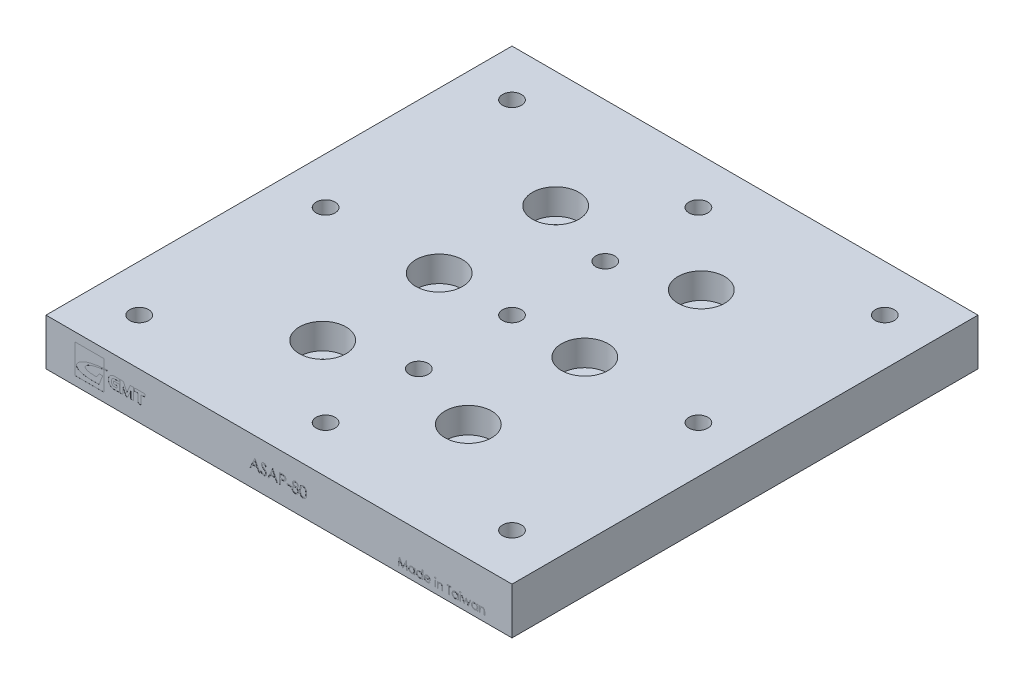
SolidWorks part; units mm, degrees
ref_plane "前基準面" through (0, 0, 0) normal (0, 0, 1) x (1, 0, 0)
ref_plane "上基準面" through (0, 0, 0) normal (0, 1, 0) x (1, 0, 0)
ref_plane "右基準面" through (0, 0, 0) normal (1, 0, 0) x (0, 0, -1)
sketch "草圖1" plane through (0, 0, 0) normal (0, 1, 0) x (1, 0, 0)
  line L1 (-40, 40) -> (40, 40)
  line L2 (-40, 40) -> (-40, -40)
  line L3 (-40, -40) -> (40, -40)
  line L4 (40, 40) -> (40, -40)
  dimension "D1" = 80
  dimension "D2" = 80
  dimension "D3" = 40
  dimension "D4" = 40
extrude "伸長1" add sketch "草圖1" along normal blind 8
ref_plane "平面1" through (0, 8, 0) normal (0, 1, 0) x (-1, 0, 0)
hole_wizard "M4 承窩頭蓋螺釘的柱孔1" positions "草圖3" profile "草圖2" counterbore size "M4" standard "JIS"
sketch "草圖3" plane through (0, 8, 0) normal (0, 1, 0) x (-1, 0, 0)
  point P0 (12.5, 20)
  dimension "D1" = 12.5
  dimension "D2" = 20
sketch "草圖2" plane through (-12.5, 8, 20) normal (1, 0, 0) x (0, 0, 1)
  line L0 (0, 0) -> (0, 8)
  line L1 (0, 8) -> (2.25, 8)
  line L3 (2.25, 8) -> (2.25, 4.4)
  line L4 (2.25, 4.4) -> (4, 4.4)
  line L5 (4, 4.4) -> (4, 0)
  line L7 (4, 0) -> (0, 0)
  line L11 (0, -6.35) -> (0, 107.95) construction
  dimension "貫穿孔直徑" = 4.5
  dimension "貫穿孔深度" = 8
  dimension "柱孔直徑" = 8
  dimension "柱孔深度" = 4.4
pattern_linear "直線複製排列1" count 2 spacing 25 along (1, 0, 0) count 3 spacing 20 along (0, 0, -1) of "M4 承窩頭蓋螺釘的柱孔1"
hole_wizard "M4x0.7 螺紋孔1" positions "草圖5" profile "草圖4" tap size "M4x0.7" standard "JIS"
sketch "草圖5" plane through (0, 8, 0) normal (0, 1, 0) x (-1, 0, 0)
  point P0 (32, 32)
  dimension "D1" = 32
  dimension "D2" = 32
sketch "草圖4" plane through (-32, 8, 32) normal (1, 0, 0) x (0, 0, 1)
  line L0 (0, 0) -> (0, 12.4764)
  line L1 (0, 12.4764) -> (1.625, 11.5)
  line L2 (1.625, 11.5) -> (1.625, 0)
  line L5 (1.625, 0) -> (0, 0)
  line L10 (0, 12.4764) -> (-1.625, 11.5) construction
  line L11 (0, -6.35) -> (0, 107.95) construction
  dimension "螺孔鑽直徑" = 3.25
  dimension "螺孔鑽深度" = 11.5
  dimension "導頭角度" = 118
pattern_linear "直線複製排列2" count 3 spacing 32 along (1, 0, 0) count 5 spacing 16 along (0, 0, -1) of "M4x0.7 螺紋孔1"
ref_plane "平面2" through (0, 0, 40) normal (0, 0, 1) x (1, 0, 0)
sketch "草圖6" plane through (0, 0, 40) normal (0, 0, 1) x (1, 0, 0)
  line L0 (-35, 6.5036) -> (-35, 1.5)
  line L1 (-35, 1.5) -> (-30.0015, 1.5)
  line L2 (-30.0015, 1.5) -> (-30.0015, 6.5036)
  line L3 (-35, 6.5036) -> (-30.0015, 6.5036)
  line L4 (-40, 0) -> (40, 0) construction
  line L5 (40, 8) -> (40, 0) construction
  dimension "D1" = 4.9985
  dimension "D2" = 5.0036
  dimension "D3" = 1.5
  dimension "D4" = 75
extrude "除料-伸長1" cut sketch "草圖6" against normal blind 0.01
sketch "草圖7" plane through (0, 0, 40) normal (0, 0, 1) x (1, 0, 0)
  line L0 (-35, 6.5036) -> (-35, 1.5)
  line L1 (-35, 1.5) -> (-30.0015, 1.5)
  line L2 (-30.0015, 1.5) -> (-30.0015, 4.8682)
  line L3 (-30.0015, 5.0224) -> (-30.0015, 6.5036)
  line L4 (-23.6912, 4.2729) -> (-23.6912, 2.7839)
  line L5 (-23.6912, 4.2729) -> (-23.1928, 4.2729)
  line L6 (-23.0365, 4.4292) -> (-23.0365, 4.7778)
  line L7 (-23.0365, 4.7778) -> (-24.8418, 4.7778)
  line L8 (-24.8418, 4.7778) -> (-24.8418, 4.2822)
  line L9 (-24.8418, 4.2822) -> (-24.1956, 4.2822)
  line L10 (-24.1956, 4.2822) -> (-24.1956, 2.943)
  line L11 (-24.0405, 2.7867) -> (-23.6912, 2.7839)
  line L12 (-24.9773, 4.7778) -> (-25.543, 4.7778)
  line L13 (-26.7119, 4.7778) -> (-27.2769, 4.7778)
  line L14 (-27.4068, 4.7778) -> (-28.4604, 4.7778)
  line L15 (-27.2769, 4.7778) -> (-27.2769, 2.7879)
  line L16 (-24.978, 2.7879) -> (-25.3139, 2.7879)
  line L17 (-25.9813, 2.7879) -> (-26.2736, 2.7879)
  line L18 (-26.941, 2.7879) -> (-27.2769, 2.7879)
  line L19 (-27.4177, 2.7879) -> (-28.4604, 2.7879)
  line L20 (-26.7119, 4.7778) -> (-26.1274, 3.4227)
  line L21 (-26.7846, 3.9449) -> (-26.7846, 2.9442)
  line L22 (-26.7846, 2.9442) -> (-26.7846, 3.9449)
  line L23 (-26.7846, 3.9449) -> (-26.2736, 2.7879)
  line L24 (-24.978, 4.7778) -> (-24.978, 2.7879)
  line L25 (-25.4703, 3.9449) -> (-25.4703, 2.9442)
  line L26 (-25.4703, 2.9442) -> (-25.4703, 3.9449)
  line L27 (-25.4703, 3.9449) -> (-25.9813, 2.7879)
  line L28 (-25.543, 4.7778) -> (-26.1274, 3.4227)
  line L29 (-27.4177, 4.0133) -> (-28.4232, 4.0133)
  line L30 (-27.4177, 4.0133) -> (-27.4177, 2.7879)
  line L31 (-28.4232, 4.0133) -> (-28.4232, 3.7451)
  line L32 (-27.8506, 3.5888) -> (-28.2668, 3.5888)
  line L33 (-27.8506, 3.5888) -> (-27.8506, 3.2081)
  line L34 (-27.8506, 3.2081) -> (-28.4604, 3.2081)
  line L35 (-27.4068, 4.7778) -> (-27.4068, 4.5291)
  line L36 (-28.4604, 4.3728) -> (-27.5632, 4.3728)
  line L37 (-30.904, 2.2321) -> (-30.2779, 3.8226)
  line L38 (-30.2779, 3.8226) -> (-30.842, 3.8222)
  line L39 (-30.842, 3.8222) -> (-31.3706, 3.1427)
  line L40 (-29.4562, 5.0787) -> (-29.4562, 4.9341)
  line L41 (-30.904, 2.2321) -> (-32.3854, 2.224)
  line L42 (-35, 6.5036) -> (-30.0015, 6.5036)
  arc A0 (-23.1928, 4.2729) -> (-23.0365, 4.4292) centre (-23.1928, 4.4292) ccw
  arc A1 (-24.1956, 2.943) -> (-24.0405, 2.7867) centre (-24.0392, 2.943) ccw
  arc A2 (-26.941, 2.7879) -> (-26.7846, 2.9442) centre (-26.941, 2.9442) ccw
  arc A3 (-25.4703, 2.9442) -> (-25.3139, 2.7879) centre (-25.3139, 2.9442) ccw
  arc A4 (-28.4232, 3.7451) -> (-28.2668, 3.5888) centre (-28.2668, 3.7451) ccw
  arc A5 (-27.5632, 4.3728) -> (-27.4068, 4.5291) centre (-27.5632, 4.5291) ccw
  arc A6 (-28.4604, 4.3728) -> (-28.4604, 3.2081) centre (-28.0971, 3.7905) ccw
  arc A7 (-28.4604, 4.7778) -> (-28.4604, 2.7879) centre (-28.2905, 3.7828) ccw
  arc A8 (-32.1055, 3.1701) -> (-31.3706, 3.1427) centre (-31.4486, 10.9141) ccw
  arc A9 (-32.707, 3.2503) -> (-32.1055, 3.1701) centre (-32.0766, 5.6836) ccw
  arc A10 (-33.1748, 3.4418) -> (-32.707, 3.2503) centre (-32.4818, 4.4675) ccw
  arc A11 (-33.2925, 3.6462) -> (-33.1748, 3.4418) centre (-33.0576, 3.6454) ccw
  arc A12 (-33.2183, 3.8151) -> (-33.2925, 3.6462) centre (-32.9716, 3.606) ccw
  arc A13 (-32.9666, 4.0385) -> (-33.2183, 3.8151) centre (-32.4029, 3.1499) ccw
  arc A14 (-32.6266, 4.2237) -> (-32.9666, 4.0385) centre (-31.5202, 1.7875) ccw
  arc A15 (-32.6266, 4.2237) -> (-32.2045, 4.3902) centre (-35.8318, 12.9711) ccw
  arc A16 (-32.2045, 4.3902) -> (-31.8263, 4.503) centre (-41.1254, 34.9772) ccw
  arc A17 (-31.4511, 4.6015) -> (-31.8263, 4.503) centre (-31.1093, 2.5348) ccw
  arc A18 (-31.4511, 4.6015) -> (-31.1369, 4.6671) centre (-31.8193, 7.1494) ccw
  arc A19 (-30.735, 4.7447) -> (-31.1369, 4.6671) centre (-28.6191, -7.2875) ccw
  arc A20 (-30.735, 4.7447) -> (-30.3551, 4.8127) centre (-31.0966, 7.8611) ccw
  arc A21 (-30.3551, 4.8127) -> (-30.0175, 4.8643) centre (-30.4846, 6.7915) ccw
  arc A22 (-29.7082, 4.907) -> (-30.0175, 4.8643) centre (-26.3991, -20.2105) ccw
  arc A23 (-29.4562, 4.9341) -> (-29.7082, 4.907) centre (-29.3892, 3.1318) ccw
  arc A24 (-32.3854, 2.224) -> (-32.8822, 2.2677) centre (-36.7931, -45.0279) ccw
  arc A25 (-33.4363, 2.3384) -> (-32.8822, 2.2677) centre (-32.1472, 10.2291) ccw
  arc A26 (-34.1655, 2.5266) -> (-33.4363, 2.3384) centre (-32.6304, 6.9672) ccw
  arc A27 (-34.6577, 2.843) -> (-34.1655, 2.5266) centre (-33.5968, 3.9528) ccw
  arc A28 (-34.7843, 3.1417) -> (-34.6577, 2.843) centre (-34.3874, 3.1337) ccw
  arc A29 (-34.6226, 3.5318) -> (-34.7843, 3.1417) centre (-34.1027, 3.0877) ccw
  arc A30 (-34.2428, 3.9044) -> (-34.6226, 3.5318) centre (-33.0306, 2.289) ccw
  arc A31 (-33.7858, 4.1645) -> (-34.2428, 3.9044) centre (-31.2186, -0.8789) ccw
  arc A32 (-33.3496, 4.3622) -> (-33.7858, 4.1645) centre (-31.4812, -0.3402) ccw
  arc A33 (-33.0363, 4.473) -> (-33.3496, 4.3622) centre (-10.5396, -59.6358) ccw
  arc A34 (-32.5964, 4.5999) -> (-33.0363, 4.473) centre (-31.6654, 0.5487) ccw
  arc A35 (-32.133, 4.7173) -> (-32.5964, 4.5999) centre (-30.7949, -1.5402) ccw
  arc A36 (-31.6988, 4.8012) -> (-32.133, 4.7173) centre (-29.3986, -8.2674) ccw
  arc A37 (-31.6988, 4.8012) -> (-31.3224, 4.8725) centre (-32.2212, 8.5851) ccw
  arc A38 (-30.985, 4.9201) -> (-31.3224, 4.8725) centre (-30.8858, 2.9959) ccw
  arc A39 (-30.5917, 4.9665) -> (-30.985, 4.9201) centre (-30.4362, 1.9563) ccw
  arc A40 (-30.2427, 5.0116) -> (-30.5917, 4.9665) centre (-29.9625, 1.4692) ccw
  arc A41 (-29.9215, 5.043) -> (-30.2427, 5.0116) centre (-29.3062, -2.8951) ccw
  arc A42 (-30.104, 5.0268) -> (-29.6911, 5.0654) centre (-32.3857, 31.6653) ccw
  arc A43 (-29.4562, 5.0787) -> (-29.6911, 5.0654) centre (-29.482, 3.4556) ccw
extrude "除料-伸長2" cut sketch "草圖7" against normal blind 0.02
sketch "草圖8" plane through (0, 0, 40) normal (0, 0, 1) x (1, 0, 0)
  line L0 (4.85, 0) -> (4.85, 2.9) construction
  line L2 (4.85, 2.9) -> (-15.15, 2.9) construction
  text T0 "ASAP-80" font "Century Gothic" height in points 5
  dimension "D1" = 4.85
extrude "除料-伸長3" cut sketch "草圖8" against normal blind 0.02
sketch "草圖10"
  dimension "D2" = 1
extrude "除料-伸長4" cut sketch "草圖10" against normal blind 0.01
